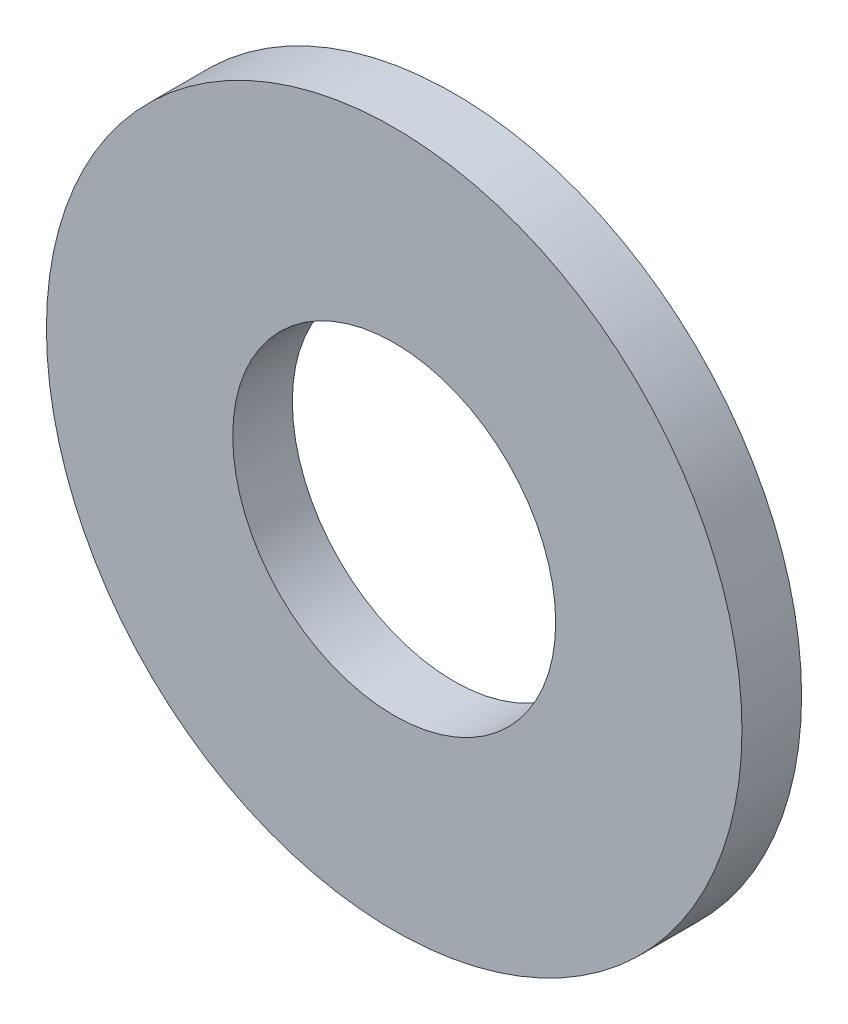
SolidWorks part; units mm, degrees
ref_plane "Plan de face" through (0, 0, 0) normal (0, 0, 1) x (1, 0, 0)
ref_plane "Plan de dessus" through (0, 0, 0) normal (0, 1, 0) x (1, 0, 0)
ref_plane "Plan de droite" through (0, 0, 0) normal (1, 0, 0) x (0, 0, -1)
sketch "Esquisse1" plane through (0, 0, 0) normal (0, 0, 1) x (1, 0, 0)
  circle A0 centre (0, 0) radius 7
  circle A1 centre (0, 0) radius 3.25
  dimension "D1" = 14
  dimension "D2" = 6.5
extrude "Extrusion1" add sketch "Esquisse1" along normal mid plane 1.2
